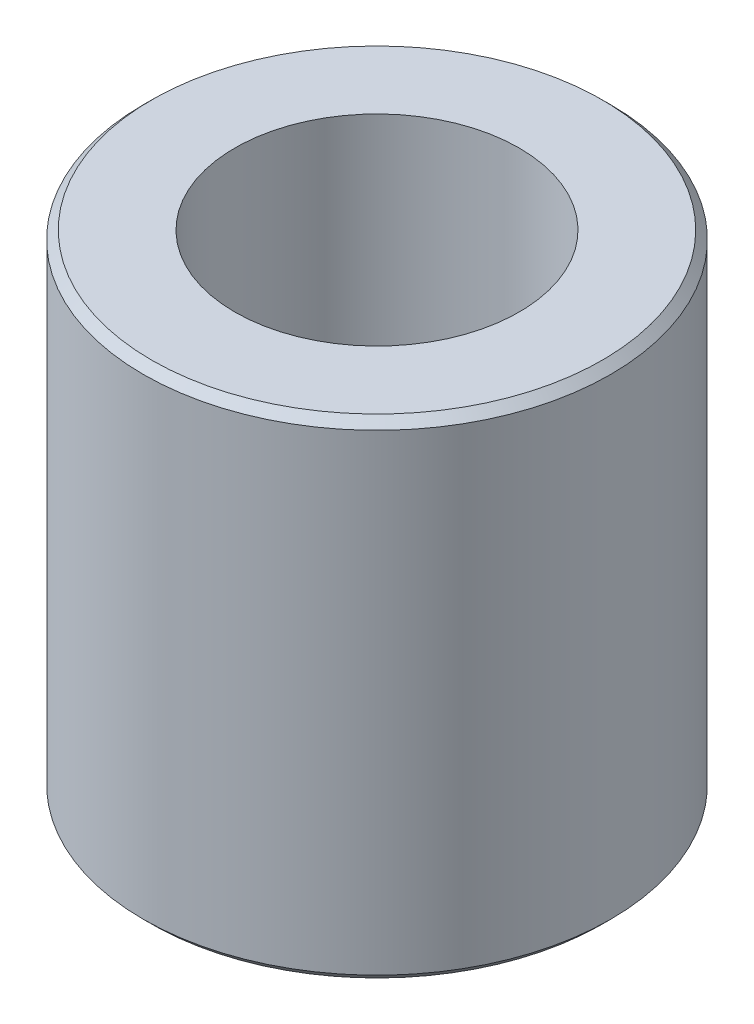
SolidWorks part; units mm, degrees
ref_plane "Front Plane" through (0, 0, 0) normal (0, 0, 1) x (1, 0, 0)
ref_plane "Top Plane" through (0, 0, 0) normal (0, 1, 0) x (1, 0, 0)
ref_plane "Right Plane" through (0, 0, 0) normal (1, 0, 0) x (0, 0, -1)
sketch "Sketch1" plane through (0, 0, 0) normal (0, 0, 1) x (1, 0, 0)
  line L0 (0, 12.4902) -> (0, -31.8413) construction
  line L1 (0, 0) -> (-14.351, 0)
  line L2 (0, 0) -> (0, -29.9974)
  line L3 (0, -29.9974) -> (-14.351, -29.9974)
  line L4 (-14.351, 0) -> (-14.351, -29.9974)
  dimension "D1" = 28.702
  dimension "D2" = 29.9974
revolve "Revolve1" add sketch "Sketch1" angle 360 about L0
hole_wizard "3/4-16 Tapped Hole1" positions "Sketch3" profile "Sketch2" tap size "3/4-16" standard "ANSI Inch"
sketch "Sketch3" plane through (0, 0, 0) normal (0, 1, 0) x (1, 0, 0)
  point P0 (0, 0)
sketch "Sketch2" plane through (0, 0, 0) normal (1, 0, 0) x (0, 0, 1)
  line L0 (0, 0) -> (0, 51.2965)
  line L1 (0, 51.2965) -> (8.7312, 46.0502)
  line L2 (8.7312, 46.0502) -> (8.7312, 0)
  line L5 (8.7312, 0) -> (0, 0)
  line L10 (0, 51.2965) -> (-8.7313, 46.0502) construction
  line L11 (0, -6.35) -> (0, 107.95) construction
  dimension "Tap Drill Dia." = 17.4625
  dimension "Tap Drill Depth" = 46.0502
  dimension "Drill Angle" = 118
sketch "Sketch4" plane through (0, 0, 0) normal (0, 0, 1) x (1, 0, 0)
  line L0 (-9.525, -29.9974) -> (-9.525, -16.0274)
  line L1 (-14.351, -29.9974) -> (14.351, -29.9974) construction
  line L2 (-9.525, -16.0274) -> (0, -10.3042)
  line L3 (0, -10.3042) -> (0, -29.9974)
  line L4 (0, -29.9974) -> (-9.525, -29.9974)
  line L5 (0, 4.8636) -> (0, -30.7737) construction
  line L6 (14.351, 0) -> (-14.351, 0) construction
  dimension "D1" = 19.05
  dimension "D2" = 13.97
  dimension "D3" = 59
  dimension "D4" = 16.0274
revolve "Cut-Revolve1" cut sketch "Sketch4" angle 360 about L5
chamfer "Chamfer1" distance 1.016 angle 45 1 edges at (0, -29.9974, 9.525)
sketch "Sketch5" plane through (0, -29.9974, 0) normal (0, -1, 0) x (1, 0, 0)
  line L1 (10.9985, 0) -> (5.4993, 9.525)
  line L2 (5.4993, 9.525) -> (-5.4993, 9.525)
  line L3 (-5.4993, 9.525) -> (-10.9985, 0)
  line L4 (-10.9985, 0) -> (-5.4993, -9.525)
  line L5 (-5.4993, -9.525) -> (5.4993, -9.525)
  line L6 (5.4993, -9.525) -> (10.9985, 0)
  circle A0 centre (0, 0) radius 9.525 construction
  circle A2 centre (0, 0) radius 9.525 construction
extrude "Cut-Extrude1" cut sketch "Sketch5" against normal blind 11.1125
chamfer "Chamfer2" distance 0.508 angle 45 2 edges at (0, -29.9974, 14.351) (0, 0, 14.351)
